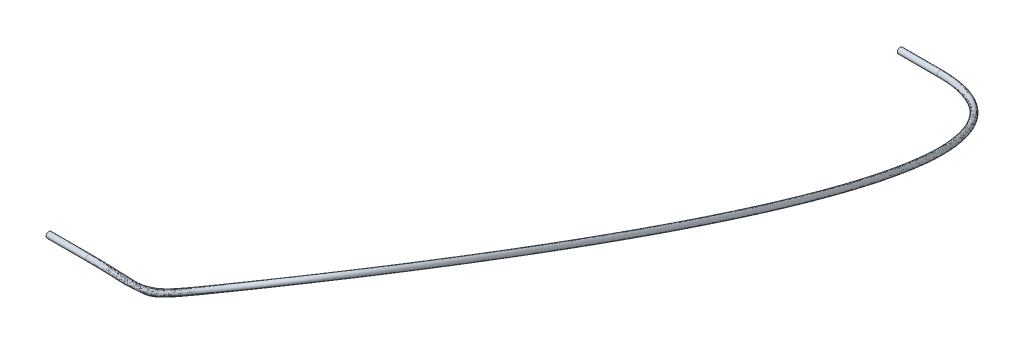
SolidWorks part; units mm, degrees
ref_plane "Front Plane" through (0, 0, 0) normal (0, 0, 1) x (1, 0, 0)
ref_plane "Top Plane" through (0, 0, 0) normal (0, 1, 0) x (1, 0, 0)
ref_plane "Right Plane" through (0, 0, 0) normal (1, 0, 0) x (0, 0, -1)
sketch3d "3DSketch1"
  line L0 (218.4139, 19.8628, -74.1065) -> (225.4139, 19.8628, -74.1065) construction
  line L1 (250.0315, 4.7752, -191.9104) -> (257.0315, 4.7752, -191.9104) construction
  line L2 (218.4139, 19.8628, -74.1065) -> (225.4139, 19.8628, -74.1065)
  line L3 (250.0315, 4.7752, -191.9104) -> (257.0315, 4.7752, -191.9104)
  spline S0 degree 3 poles (743.3213, 1247.7714, 1416.4758) (58.546, -210.8, -384.8771) (484.4613, 394.4796, 490.5051) (148.1139, -372.0135, -912.6805) (62.5699, 892.0215, 1586.6554) knots -0.780324 -0.780324 -0.780324 -0.780324 0.291813 2.023362 2.023362 2.023362 2.023362 only from (225.4139, 19.8628, -74.1065) to (257.0315, 4.7752, -191.9104) construction
  spline S1 degree 3 poles (225.4139, 19.8628, -74.1065) (236.5813, 19.8628, -74.1065) (312.8245, 99.5746, 11.9266) (292.0957, 4.7752, -191.9104) (257.0315, 4.7752, -191.9104) knots 0 0 0 0 0.291813 1 1 1 1
ref_plane "Plane1" through (218.4139, 19.8628, -74.1065) normal (1, 0, 0) x (0, 0, -1)
sketch "PipeSketch" plane through (218.4139, 19.8628, -74.1065) normal (1, 0, 0) x (0, 0, -1)
  circle A0 centre (0, 0) radius 0.5
  dimension "OuterDiameter" = 1
sweep "Cable_1" add profiles "PipeSketch" path "3DSketch1"
